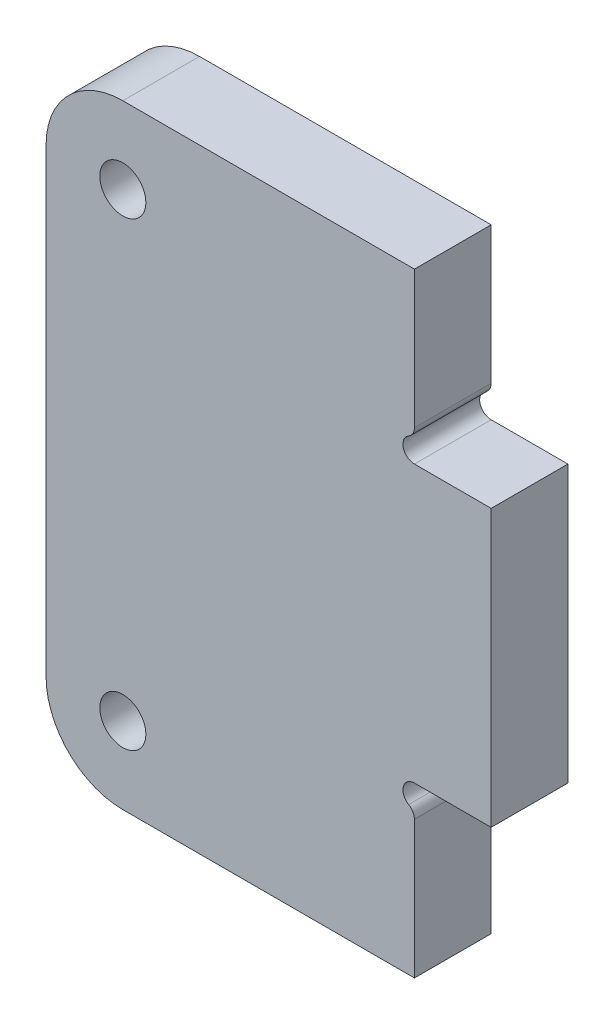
SolidWorks part; units mm, degrees
ref_plane "Plan de face" through (0, 0, 0) normal (0, 0, 1) x (1, 0, 0)
ref_plane "Plan de dessus" through (0, 0, 0) normal (0, 1, 0) x (1, 0, 0)
ref_plane "Plan de droite" through (0, 0, 0) normal (1, 0, 0) x (0, 0, -1)
sketch "Esquisse1" plane through (0, 0, 0) normal (0, 0, 1) x (1, 0, 0)
  line L0 (28.0466, -18) -> (38.0466, -18)
  line L1 (38.0466, -18) -> (38.0466, 18)
  line L2 (38.0466, 18) -> (28.0466, 18)
  line L3 (28.0466, 22.0981) -> (28.0466, 40)
  line L4 (28.0466, 40) -> (-9.9534, 40)
  line L5 (-19.9534, 30) -> (-19.9534, -30)
  line L6 (-9.9534, -40) -> (28.0466, -40)
  line L7 (28.0466, -40) -> (28.0466, -22.0981)
  arc A0 (28.0466, -22.0981) -> (27.2966, -20.799) centre (26.5466, -22.0981) ccw
  arc A1 (28.0466, -18) -> (27.2966, -20.799) centre (28.0466, -19.5) ccw
  arc A2 (27.2966, 20.799) -> (28.0466, 18) centre (28.0466, 19.5) ccw
  arc A3 (27.2966, 20.799) -> (28.0466, 22.0981) centre (26.5466, 22.0981) ccw
  circle A6 centre (-9.9534, -30) radius 3
  circle A7 centre (-9.9534, 30) radius 3
  arc A8 (-9.9534, 40) -> (-19.9534, 30) centre (-9.9534, 30) ccw
  arc A9 (-19.9534, -30) -> (-9.9534, -40) centre (-9.9534, -30) ccw
  dimension "D1" = 6
  dimension "D2" = 10
  dimension "D8" = 1.5
  dimension "D9" = 1.5
  dimension "D11" = 1.5
  dimension "D12" = 1.5
  dimension "D17" = 10
  dimension "D18" = 10
  dimension "D3" = 36
  dimension "D4" = 18
  dimension "D5" = 22
  dimension "D6" = 22
  dimension "D7" = 58
  dimension "D10" = 10
  dimension "D13" = 30
  dimension "D14" = 30
  dimension "D15" = 38
  dimension "D16" = 38
extrude "Boss.-Extru.1" add sketch "Esquisse1" along normal blind 10
